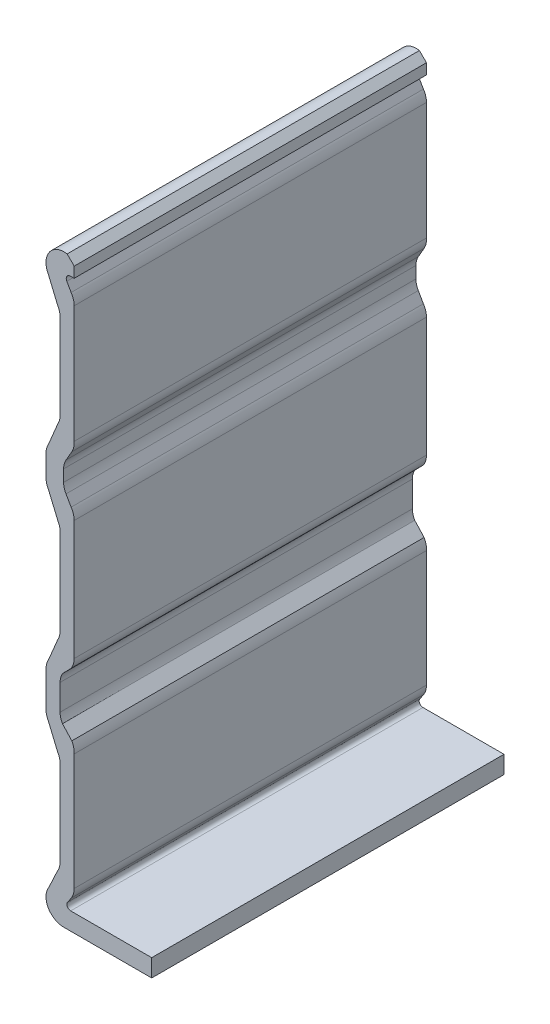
SolidWorks part; units mm, degrees
ref_plane "Front Plane" through (0, 0, 0) normal (0, 0, 1) x (1, 0, 0)
ref_plane "Top Plane" through (0, 0, 0) normal (0, 1, 0) x (1, 0, 0)
ref_plane "Right Plane" through (0, 0, 0) normal (1, 0, 0) x (0, 0, -1)
sketch "Sketch1" plane through (0, 0, 0) normal (0, 0, 1) x (1, 0, 0)
  line L0 (-22.67, 46.9644) -> (-25.3303, 49.8401)
  line L1 (-26.0002, 52.3401) -> (-26.0002, 59.6607)
  line L2 (-25.3303, 62.1607) -> (-22.8651, 64.6985)
  line L3 (-22.0002, 67.5364) -> (-22.0002, 101.4648)
  line L4 (-22.8651, 104.3027) -> (-24.3303, 106.8405)
  line L5 (-25.0002, 109.3405) -> (-25.0002, 112.6611)
  line L6 (-24.3303, 115.1611) -> (-22.67, 118.0367)
  line L7 (-22.0002, 120.92) -> (-22.0002, 154.2447)
  line L8 (-22.8651, 157.0826) -> (-24.1002, 159.2219)
  line L9 (-23.073, 161.0011) -> (-22.0002, 161.0011)
  line L10 (-22.0002, 161.0011) -> (-22.0002, 164.0012)
  line L11 (-22.0002, 164.0012) -> (-24.0002, 166.0012)
  line L12 (-29.3303, 158.2806) -> (-26.6695, 151.9408)
  line L13 (-26.0002, 125.4134) -> (-26.0002, 149.368)
  line L14 (-29.3303, 116.5008) -> (-26.6695, 122.8406)
  line L15 (-30.0002, 108.0008) -> (-30.0002, 114.0008)
  line L16 (-29.3303, 105.5007) -> (-26.6695, 99.161)
  line L17 (-25.9997, 72.3403) -> (-25.9997, 96.6609)
  line L18 (-29.3303, 63.5004) -> (-26.6695, 69.8402)
  line L19 (-30.0002, 51.0004) -> (-30.0002, 61.0004)
  line L20 (-29.3303, 48.5003) -> (-26.6695, 42.1606)
  line L21 (-26.0002, 15.5896) -> (-26.0002, 39.5877)
  line L22 (-29.1576, 7.7778) -> (-26.8423, 12.739)
  line L23 (-25.0002, 0) -> (0, 0)
  line L24 (0, 0) -> (0, 5)
  line L25 (0, 5) -> (-23.0069, 5)
  line L26 (-23.8928, 6.6574) -> (-22.8428, 8.229)
  line L27 (-22.0002, 11.0068) -> (-22.0002, 44.0812)
  arc A0 (-22.0002, 44.0812) -> (-22.67, 46.9644) centre (-27.2518, 44.3805) ccw
  arc A1 (-25.3303, 49.8401) -> (-26.0002, 52.3401) centre (-21.0001, 52.3401) cw
  arc A2 (-26.0002, 59.6607) -> (-25.3303, 62.1607) centre (-21.0001, 59.6607) cw
  arc A3 (-22.8651, 64.6985) -> (-22.0002, 67.5364) centre (-27.1873, 67.5666) ccw
  arc A4 (-22.0002, 101.4648) -> (-22.8651, 104.3027) centre (-27.1873, 101.4346) ccw
  arc A5 (-24.3303, 106.8405) -> (-25.0002, 109.3405) centre (-20.0001, 109.3405) cw
  arc A6 (-25.0002, 112.6611) -> (-24.3303, 115.1611) centre (-20.0001, 112.6611) cw
  arc A7 (-22.67, 118.0367) -> (-22.0002, 120.92) centre (-27.2518, 120.6207) ccw
  arc A8 (-22.0002, 154.2447) -> (-22.8651, 157.0826) centre (-27.1873, 154.2145) ccw
  arc A9 (-24.1002, 159.2219) -> (-23.073, 161.0011) centre (-23.073, 159.815) cw
  arc A10 (-24.0002, 166.0012) -> (-30.0002, 160.7806) centre (-24.8726, 160.9457) ccw
  arc A11 (-30.0002, 160.7806) -> (-29.3303, 158.2806) centre (-25.0002, 160.7806) ccw
  arc A12 (-26.6695, 151.9408) -> (-26.0002, 149.368) centre (-30.9997, 149.4408) cw
  arc A13 (-26.0002, 125.4134) -> (-26.6695, 122.8406) centre (-30.9997, 125.3406) cw
  arc A14 (-29.3303, 116.5008) -> (-30.0002, 114.0008) centre (-25.0002, 114.0008) ccw
  arc A15 (-30.0002, 108.0008) -> (-29.3303, 105.5007) centre (-25.0002, 108.0008) ccw
  arc A16 (-26.6695, 99.161) -> (-25.9997, 96.6609) centre (-30.9997, 96.6609) cw
  arc A17 (-25.9997, 72.3403) -> (-26.6695, 69.8402) centre (-30.9997, 72.3403) cw
  arc A18 (-29.3303, 63.5004) -> (-30.0002, 61.0004) centre (-25.0002, 61.0004) ccw
  arc A19 (-30.0002, 51.0004) -> (-29.3303, 48.5003) centre (-25.0002, 51.0004) ccw
  arc A20 (-26.6695, 42.1606) -> (-26.0002, 39.5877) centre (-30.9997, 39.6605) cw
  arc A21 (-26.0002, 15.5896) -> (-26.8423, 12.739) centre (-30.9997, 15.5168) cw
  arc A22 (-29.1576, 7.7778) -> (-25.0002, 0) centre (-25.0002, 5) ccw
  arc A23 (-23.0069, 5) -> (-23.8928, 6.6574) centre (-23.0069, 6.0655) cw
  arc A24 (-22.8428, 8.229) -> (-22.0002, 11.0068) centre (-27.0002, 11.0068) ccw
  dimension "D1" = 166.0012
  dimension "D2" = 5
  dimension "D3" = 8.0001
extrude "Extrude1" add sketch "Sketch1" along normal mid plane 100
